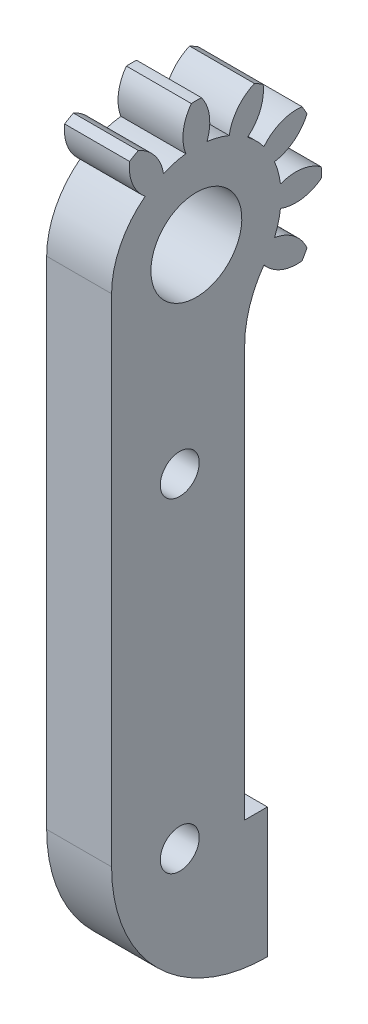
SolidWorks part; units mm, degrees
ref_plane "Front Plane" through (0, 0, 0) normal (0, 0, 1) x (1, 0, 0)
ref_plane "Top Plane" through (0, 0, 0) normal (0, 1, 0) x (1, 0, 0)
ref_plane "Right Plane" through (0, 0, 0) normal (1, 0, 0) x (0, 0, -1)
imported_body "spur gear_iso-1-solid1"
sketch "Sketch1" plane through (2.8161, 0, 0) normal (1, 0, 0) x (0, 0, -1)
  line L0 (-2.2131, 9.4608) -> (0.2781, 0.1637) construction
  line L1 (0.2781, 0.1637) -> (0.2781, 6.694) construction
  arc A0 (-1.8339, 9.5542) -> (-2.5882, 9.3521) centre (0.2781, 0.1637) ccw construction
  arc A1 (1.1668, 6.6332) -> (-0.6107, 6.6332) centre (0.2781, 0.1637) ccw construction
  dimension "D1" = 15
move or copy body "Body-Move/Copy1" bodies to move or copy 101 copy no rotation origin (0, 0, 0) rotation axis (1, 0, 0) rotation angle 15
sketch "Sketch2" plane through (2.8161, 0, 0) normal (1, 0, 0) x (0, 0, -1)
  line L0 (-4.3914, 4.8477) -> (4.8438, -4.3875) construction
  arc A0 (-3.72, 5.4332) -> (-4.9769, 4.1763) centre (0.2262, 0.2301) ccw construction
  arc A1 (4.1724, -4.9729) -> (5.4293, -3.716) centre (0.2262, 0.2301) ccw construction
  arc A2 (-4.3914, 4.8477) -> (4.8438, -4.3875) centre (0.2262, 0.2301) ccw
  arc A3 (-4.9769, -3.716) -> (-3.72, -4.9729) centre (0.2262, 0.2301) ccw construction
extrude "Cut-Extrude-Thin1" cut sketch "Sketch2" against normal through all and the other way through all flip side to cut thin
sketch "Sketch3" plane through (2.8161, 0, 0) normal (1, 0, 0) x (0, 0, -1)
  line L0 (-6.3041, 0.2301) -> (-6.3041, -38)
  line L1 (3.9459, -40) -> (5.6959, -40)
  line L2 (5.6959, -40) -> (5.6959, -50)
  line L3 (3.9459, -40) -> (3.9459, -8.3564)
  line L4 (5.4293, -50) -> (-18.5724, -50) construction
  arc A0 (3.9459, -8.3564) -> (5.4293, -3.716) centre (11.9459, -8.3564) cw
  arc A1 (-3.72, 5.4332) -> (5.4293, -3.716) centre (0.2262, 0.2301) ccw construction
  arc A2 (-6.3041, -38) -> (5.6959, -50) centre (5.6959, -38) ccw
  arc A4 (-6.3041, 0.2301) -> (5.4293, -3.716) centre (0.2262, 0.2301) ccw
  dimension "D1" = 8
  dimension "D4" = 12
  dimension "D2" = 50
  dimension "D3" = 10.25
  dimension "D5" = 10
extrude "Boss-Extrude1" add sketch "Sketch3" against normal up to surface (5 mm away)
sketch "Sketch4" plane through (-2.1839, 0, 0) normal (-1, 0, 0) x (0, 0, 1)
  circle A0 centre (1.0541, -14.4108) radius 1.5
  circle A1 centre (1.0541, -39.4108) radius 1.5
  dimension "D1" = 3
extrude "Cut-Extrude1" cut sketch "Sketch4" against normal up to next contours A1 | A0
